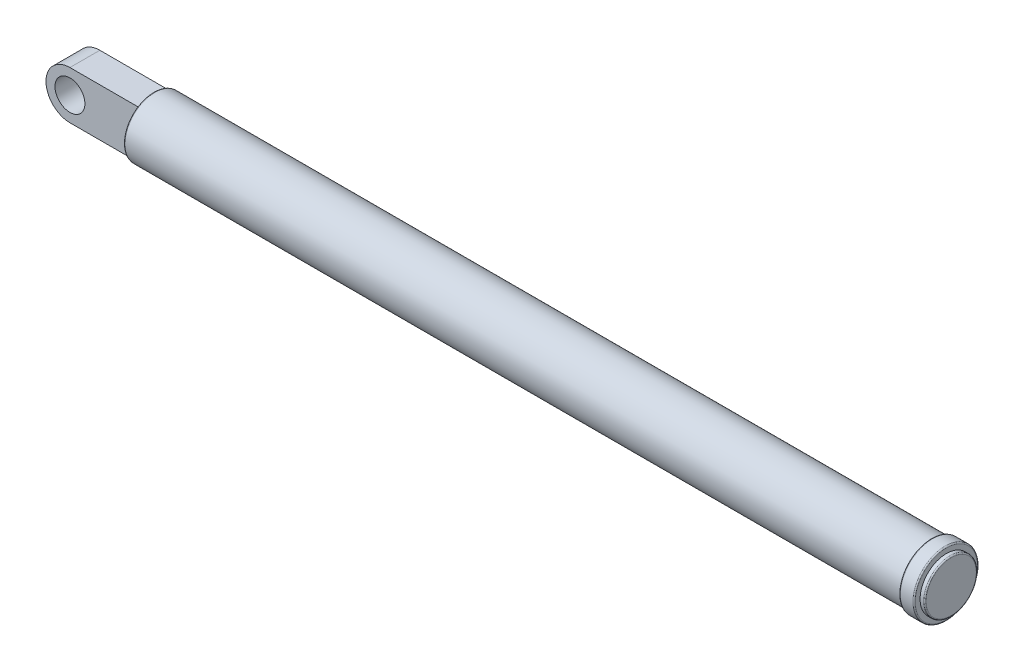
SolidWorks part; units mm, degrees
ref_plane "Face" through (0, 0, 0) normal (0, 0, 1) x (1, 0, 0)
ref_plane "Dessus" through (0, 0, 0) normal (0, 1, 0) x (1, 0, 0)
ref_plane "Droite" through (0, 0, 0) normal (1, 0, 0) x (0, 0, -1)
sketch "Esquisse1" plane through (0, 0, 0) normal (1, 0, 0) x (0, 0, -1)
  circle A0 centre (0, 0) radius 50
  dimension "D1" = 100
extrude "Extrusion1" add sketch "Esquisse1" along normal blind 1300
sketch "Esquisse2" plane through (1300, 0, 0) normal (1, 0, 0) x (0, 0, -1)
  circle A0 centre (0, 0) radius 54
  dimension "D1" = 108
extrude "Extrusion2" add sketch "Esquisse2" along normal blind 25
sketch "Esquisse3" plane through (1325, 0, 0) normal (1, 0, 0) x (0, 0, -1)
  circle A0 centre (0, 0) radius 44
  dimension "D1" = 88
extrude "Extrusion3" add sketch "Esquisse3" along normal blind 8
fillet "Congé1" radius 2 4 edges at (0, 0, -50) (1333, 0, -44) (1325, 0, -54) (1300, 0, -54)
sketch "Esquisse4" plane through (0, 0, 0) normal (0, 0, 1) x (1, 0, 0)
  line L0 (-115, 40) -> (2, 40)
  line L1 (2, 50) -> (2, -50) construction
  line L2 (-115, -40) -> (2, -40)
  line L3 (2, -40) -> (2, 40)
  circle A0 centre (-115, 0) radius 25
  arc A1 (-115, 40) -> (-115, -40) centre (-115, 0) ccw
  dimension "D1" = 50
  dimension "D3" = 80
  dimension "D2" = 115
extrude "Extrusion4" add sketch "Esquisse4" along normal mid plane 50
